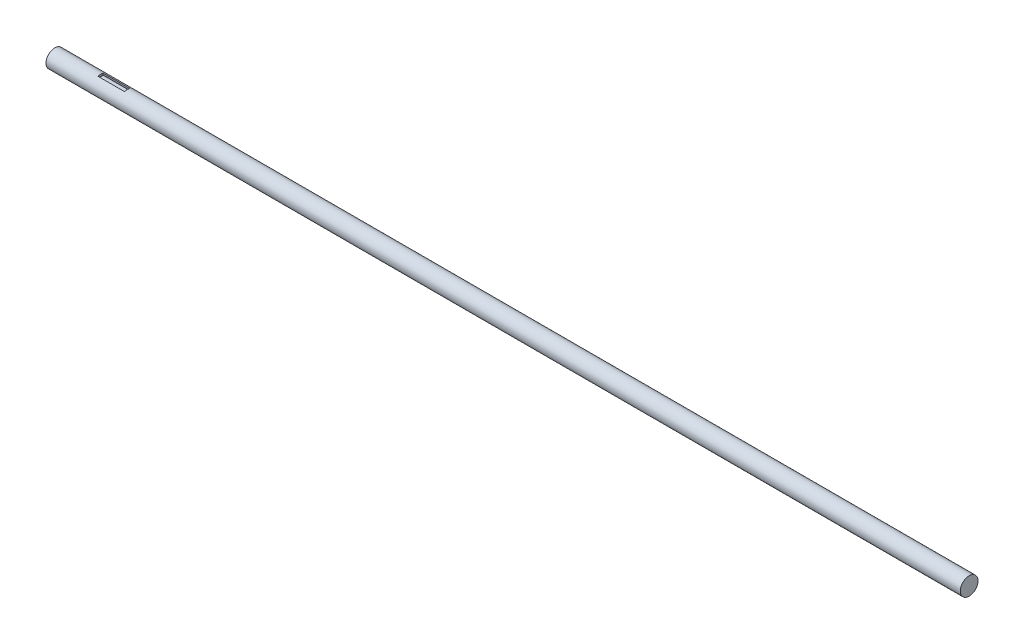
SolidWorks part; units mm, degrees
ref_plane "Front Plane" through (0, 0, 0) normal (0, 0, 1) x (1, 0, 0)
ref_plane "Top Plane" through (0, 0, 0) normal (0, 1, 0) x (1, 0, 0)
ref_plane "Right Plane" through (0, 0, 0) normal (1, 0, 0) x (0, 0, -1)
sketch "Sketch1" plane through (0, 0, 0) normal (1, 0, 0) x (0, 0, -1)
  circle A0 centre (0, 0) radius 30
  dimension "D1" = 60
extrude "Boss-Extrude1" add sketch "Sketch1" along normal blind 3100
ref_plane "Plane1" through (0, 30, 0) normal (0, 1, 0) x (1, 0, 0)
sketch "Sketch4" plane through (0, 30, 0) normal (0, 1, 0) x (1, 0, 0)
  line L0 (0, 30) -> (0, -30) construction
  line L1 (0, 30) -> (0, -30)
  line L3 (155, 9) -> (245, 9)
  line L4 (155, 9) -> (155, -9)
  line L5 (155, -9) -> (245, -9)
  line L6 (245, 9) -> (245, -9)
  line L7 (155, 9) -> (245, -9) construction
  line L8 (155, -9) -> (245, 9) construction
  point P2 (200, 0)
  point P7 (0, 0)
  point P8 (0, 0)
  point P12 (0, 0)
  dimension "D1" = 18
  dimension "D2" = 90
  dimension "D3" = 200
extrude "Cut-Extrude1" cut sketch "Sketch4" against normal blind 7 contours L6 L3 L4 L5
fillet "Fillet1" radius 0.6 4 edges at (200, 23, 9) (245, 23, 0) (155, 23, 0) (200, 23, -9)
